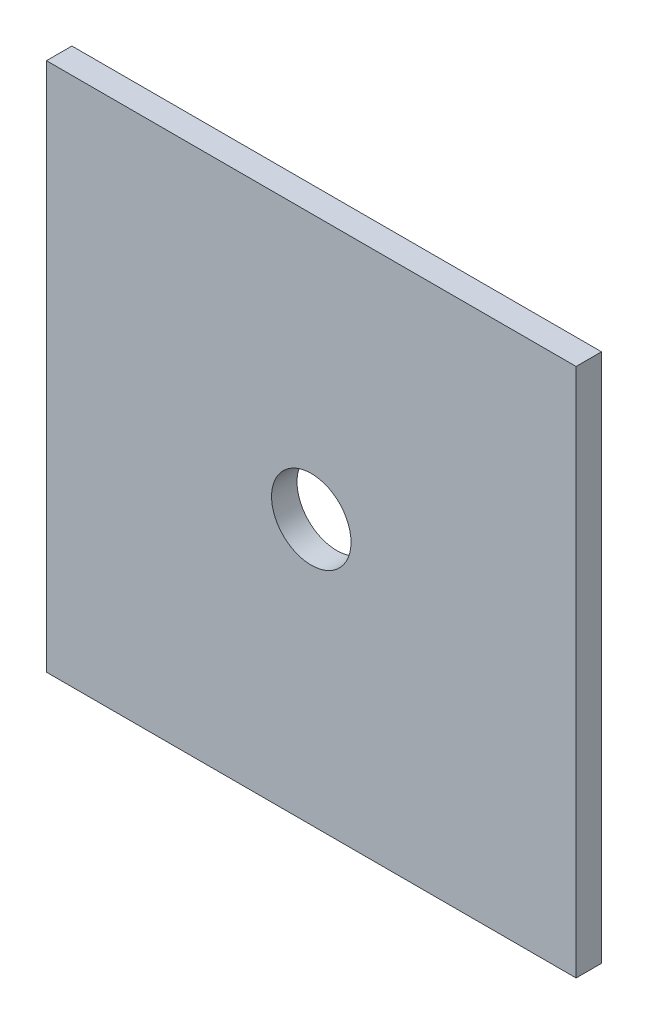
SolidWorks part; units mm, degrees
ref_plane "Front Plane" through (0, 0, 0) normal (0, 0, 1) x (1, 0, 0)
ref_plane "Top Plane" through (0, 0, 0) normal (0, 1, 0) x (1, 0, 0)
ref_plane "Right Plane" through (0, 0, 0) normal (1, 0, 0) x (0, 0, -1)
sketch "Sketch1" plane through (0, 0, 0) normal (0, 0, 1) x (1, 0, 0)
  line L1 (0, 0) -> (25.4, 0)
  line L2 (0, 0) -> (0, -25.4)
  line L3 (0, -25.4) -> (25.4, -25.4)
  line L4 (25.4, 0) -> (25.4, -25.4)
  dimension "D1" = 25.4
  dimension "D2" = 25.4
base flange "Base-Flange1" sketch "Sketch1" thickness 1.2192 reverse thickness direction no parameters "D1"=0.7366
sketch "Sketch6" plane through (0, 0, 0) normal (0, 0, 1) x (1, 0, 0)
  line L1 (25.4, 0) -> (0, 0) construction
  line L2 (0, 0) -> (0, -25.4) construction
  circle A0 centre (12.7, -12.7) radius 1.905
  point P4 (12.7, 0)
  point P7 (0, -12.7)
  dimension "D1" = 3.81
extrude "Cut-Extrude1" cut sketch "Sketch6" against normal blind 2.54
sketch "Bend-Lines1" [suppressed] plane through (0, 0, 0) normal (0, 1, 0) x (1, 0, 0)
sketch "Bounding-Box1" [suppressed] plane through (0, 0, 0) normal (0, 1, 0) x (1, 0, 0)
sheet metal parameters "Sheet-Metal1" thickness 1.2192 parameters "D1"=0.7366
flat pattern "Flat-Pattern1"
sketch "Bend-Lines2" plane through (0, 0, 0) normal (0, 1, 0) x (1, 0, 0)
sketch3d "Bounding-Box2" [suppressed]
  line L0 (0, -76.2, 0) -> (-76.2, -76.2, 0) construction
  line L1 (0, 0, 0) -> (-76.2, 0, 0) construction
  line L2 (0, -76.2, 0) -> (0, 0, 0) construction
  line L3 (-76.2, -76.2, 0) -> (-76.2, 0, 0) construction
sheet metal parameters "Sheet-Metal2" thickness 1.2192 parameters "D1"=0.7366
flat pattern "Flat-Pattern1"
sketch "Bend-Lines2" plane through (0, 0, 0) normal (0, 1, 0) x (1, 0, 0)
sketch3d "Bounding-Box2" [suppressed]
  line L0 (0, -25.4, 0) -> (25.4, -25.4, 0) construction
  line L1 (0, 0, 0) -> (25.4, 0, 0) construction
  line L2 (0, -25.4, 0) -> (0, 0, 0) construction
  line L3 (25.4, -25.4, 0) -> (25.4, 0, 0) construction
